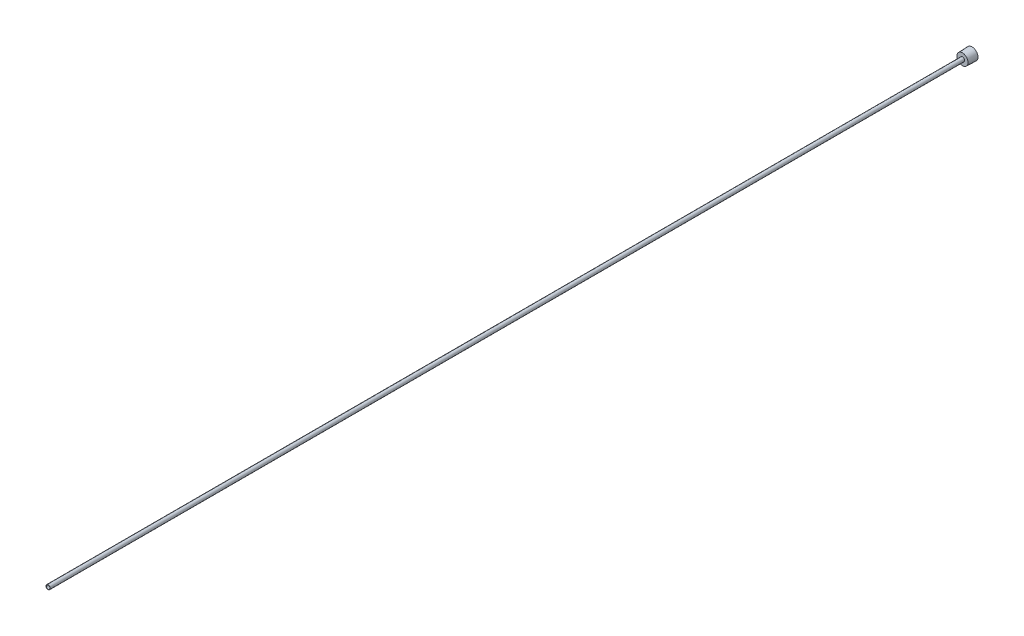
SolidWorks part; units mm, degrees
ref_plane "Front Plane" through (0, 0, 0) normal (0, 0, 1) x (1, 0, 0)
ref_plane "Top Plane" through (0, 0, 0) normal (0, 1, 0) x (1, 0, 0)
ref_plane "Right Plane" through (0, 0, 0) normal (1, 0, 0) x (0, 0, -1)
sketch "Sketch1" plane through (0, 0, 0) normal (1, 0, 0) x (0, 0, -1)
  line L0 (-609.6, 0) -> (0, 0)
  line L5 (0, 3.8989) -> (-6.35, 3.6674)
  line L6 (0, 0) -> (0, 3.8989)
  line L7 (-6.35, 3.6674) -> (-6.35, 1.3891)
  line L8 (-6.35, 1.3891) -> (-609.6, 1.3891)
  line L9 (-609.6, 1.3891) -> (-609.6, 0)
  line L10 (0, 0) -> (49989.3417, 0) construction
  dimension "D1" = 2.088
  dimension "D2" = 6.35
  dimension "D3" = 609.6
  dimension "D4" = 2.7781
  dimension "D5" = 7.7978
revolve "Revolve1" add sketch "Sketch1" angle 360 about L10
sketch "Sketch2" plane through (0, 0, 609.6) normal (0, 0, 1) x (1, 0, 0)
  circle A0 centre (0, 0) radius 1.2065
  dimension "D1" = 2.413
extrude "Cut-Extrude1" cut sketch "Sketch2" against normal through all
sketch "Sketch3" plane through (0, 0, 0) normal (0, 0, -1) x (-1, 0, 0)
  line L0 (0, 4.2888) -> (0, -4.2888) construction
  line L1 (0, -2.757) -> (2.3876, -1.3785)
  line L2 (2.3876, -1.3785) -> (2.3876, 1.3785)
  line L3 (2.3876, 1.3785) -> (0, 2.757)
  line L4 (0, 2.757) -> (-2.3876, 1.3785)
  line L5 (-2.3876, 1.3785) -> (-2.3876, -1.3785)
  line L6 (-2.3876, -1.3785) -> (0, -2.757)
  circle A0 centre (0, 0) radius 2.3876 construction
  dimension "D1" = 4.7752
extrude "Cut-Extrude2" cut sketch "Sketch3" against normal blind 3.9688
